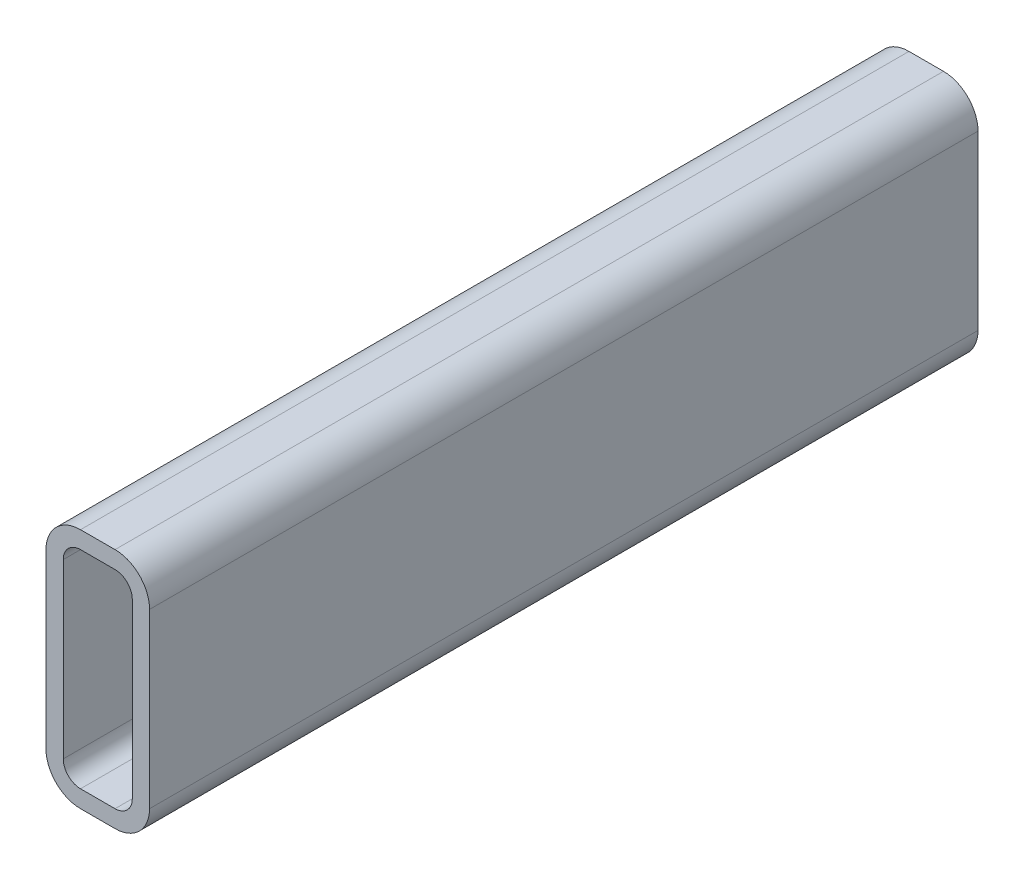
SolidWorks part; units mm, degrees
ref_plane "Front Plane" through (0, 0, 0) normal (0, 0, 1) x (1, 0, 0)
ref_plane "Top Plane" through (0, 0, 0) normal (0, 1, 0) x (1, 0, 0)
ref_plane "Right Plane" through (0, 0, 0) normal (1, 0, 0) x (0, 0, -1)
sketch "Sketch1" plane through (0, 0, 0) normal (0, 0, 1) x (1, 0, 0)
  line B0 (12.7, 88.9) -> (25.4, 88.9)
  arc B1 (38.1, 76.2) -> (25.4, 88.9) centre (25.4, 76.2) ccw
  line B2 (38.1, 76.2) -> (38.1, 12.7)
  arc B3 (25.4, 0) -> (38.1, 12.7) centre (25.4, 12.7) ccw
  line B4 (25.4, 0) -> (12.7, 0)
  arc B5 (0, 12.7) -> (12.7, 0) centre (12.7, 12.7) ccw
  line B6 (0, 12.7) -> (0, 76.2)
  arc B7 (12.7, 88.9) -> (0, 76.2) centre (12.7, 76.2) ccw
  line B8 (12.7, 82.55) -> (25.4, 82.55)
  arc B9 (31.75, 76.2) -> (25.4, 82.55) centre (25.4, 76.2) ccw
  line B10 (31.75, 76.2) -> (31.75, 12.7)
  arc B11 (25.4, 6.35) -> (31.75, 12.7) centre (25.4, 12.7) ccw
  line B12 (25.4, 6.35) -> (12.7, 6.35)
  arc B13 (6.35, 12.7) -> (12.7, 6.35) centre (12.7, 12.7) ccw
  line B14 (6.35, 12.7) -> (6.35, 76.2)
  arc B15 (12.7, 82.55) -> (6.35, 76.2) centre (12.7, 76.2) ccw
sketch_block_instance "HSS3.5x1.5x0.250-1"
sketch_block "HSS3.5x1.5x0.250"
extrude "Boss-Extrude1" add sketch "Sketch1" along normal blind 304.8
